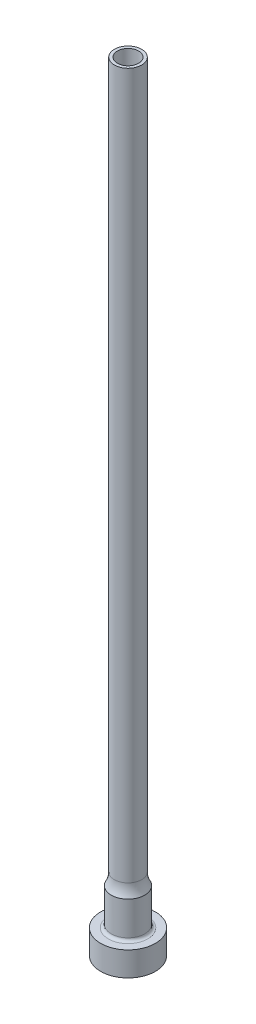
SolidWorks part; units mm, degrees
ref_plane "Front Plane" through (0, 0, 0) normal (0, 0, 1) x (1, 0, 0)
ref_plane "Top Plane" through (0, 0, 0) normal (0, 1, 0) x (1, 0, 0)
ref_plane "Right Plane" through (0, 0, 0) normal (1, 0, 0) x (0, 0, -1)
sketch "Sketch1" plane through (0, 0, 0) normal (0, 0, 1) x (1, 0, 0)
  line L0 (0, 0) -> (0, 50000) construction
  line L1 (2.9045, 0) -> (7.1374, 0)
  line L2 (7.1374, 0) -> (7.1374, 6.35)
  line L3 (7.1374, 6.35) -> (4.3688, 6.35)
  line L4 (4.3688, 6.35) -> (4.3688, 15.875)
  line L6 (3.5649, 18.9675) -> (3.5649, 203.2)
  line L7 (3.5649, 203.2) -> (2.7775, 203.2)
  line L8 (2.7775, 203.2) -> (2.7775, 139.7)
  line L9 (2.7775, 139.7) -> (2.9045, 139.6267)
  line L10 (2.9045, 139.6267) -> (2.9045, 0)
  arc A0 (3.5649, 18.9675) -> (4.3688, 15.875) centre (9.9149, 18.9675) ccw
  point P15 (4.3688, 15.875)
  dimension "D8" = 6.35
  dimension "D1" = 203.2
  dimension "D2" = 6.35
  dimension "D3" = 7.1298
  dimension "D4" = 5.555
  dimension "D5" = 8.7376
  dimension "D6" = 14.2748
  dimension "D7" = 5.809
  dimension "D9" = 15.875
  dimension "D10" = 60
  dimension "D11" = 63.5
revolve "Revolve1" add sketch "Sketch1" angle 360 about L0
fillet "Fillet1" radius 0.762 1 edges at (0, 6.35, -4.3688)
